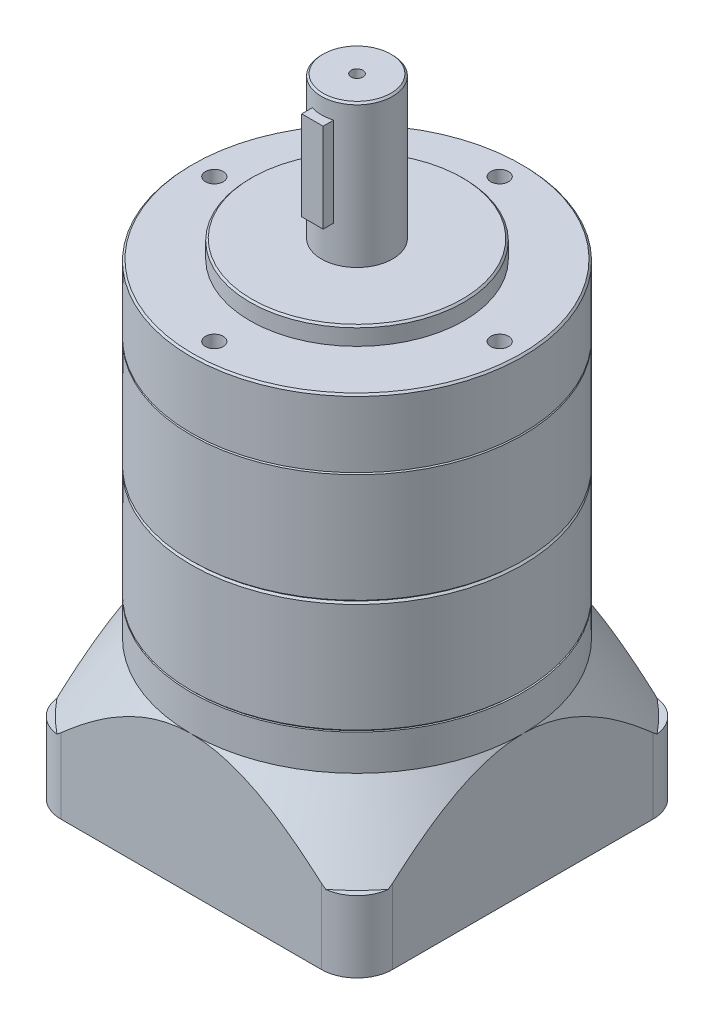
SolidWorks part; units mm, degrees
ref_plane "前基準面" through (0, 0, 0) normal (0, 0, 1) x (1, 0, 0)
ref_plane "上基準面" through (0, 0, 0) normal (0, 1, 0) x (1, 0, 0)
ref_plane "右基準面" through (0, 0, 0) normal (1, 0, 0) x (0, 0, -1)
sketch "草圖1" plane through (0, 0, 0) normal (0, 1, 0) x (1, 0, 0)
  line L1 (-36.5, -46.5) -> (36.5, -46.5)
  line L2 (-46.5, -36.5) -> (-46.5, 36.5)
  line L3 (-36.5, 46.5) -> (36.5, 46.5)
  line L4 (46.5, -36.5) -> (46.5, 36.5)
  line L5 (-46.5, -46.5) -> (46.5, 46.5) construction
  line L6 (-46.5, 46.5) -> (46.5, -46.5) construction
  arc A0 (36.5, -46.5) -> (46.5, -36.5) centre (36.5, -36.5) ccw
  arc A1 (-36.5, -46.5) -> (-46.5, -36.5) centre (-36.5, -36.5) cw
  arc A2 (36.5, 46.5) -> (46.5, 36.5) centre (36.5, 36.5) cw
  arc A3 (-46.5, 36.5) -> (-36.5, 46.5) centre (-36.5, 36.5) cw
  point P0 (0, 0)
  dimension "D3" = 10
  dimension "D1" = 93
  dimension "D2" = 93
extrude "填料-伸長1" add sketch "草圖1" along normal blind 49
sketch "草圖2" plane through (0, 49, 0) normal (0, 1, 0) x (1, 0, 0)
  circle A0 centre (0, 0) radius 46.5
extrude "除料-伸長3" cut sketch "草圖2" along normal blind 10 and the other way blind 19 draft 35 from offset 10 flip side to cut
sketch "草圖3" plane through (0, 49, 0) normal (0, 1, 0) x (1, 0, 0)
  circle A0 centre (0, 0) radius 46.5
extrude "填料-伸長2" add sketch "草圖3" along normal blind 31.5 separate body
sketch "草圖15" plane through (0, 80.5, 0) normal (0, 1, 0) x (1, 0, 0)
  circle A0 centre (0, 0) radius 46.5
extrude "填料-伸長8" add sketch "草圖15" along normal blind 31.5 separate body
sketch "草圖4" plane through (0, 112, 0) normal (0, 1, 0) x (1, 0, 0)
  circle A0 centre (0, 0) radius 46.5
extrude "填料-伸長3" add sketch "草圖4" along normal blind 19 separate body
sketch "草圖6" plane through (0, 131, 0) normal (0, 1, 0) x (1, 0, 0)
  circle A0 centre (0, 0) radius 30
  dimension "D1" = 60
extrude "填料-伸長5" add sketch "草圖6" along normal blind 5
sketch "草圖7" plane through (0, 136, 0) normal (0, 1, 0) x (1, 0, 0)
  circle A0 centre (0, 0) radius 10
  dimension "D1" = 20
extrude "填料-伸長6" add sketch "草圖7" along normal blind 40
chamfer "導角2" distance 0.5 angle 45 3 edges at (0, 176, 10) (0, 131, 46.5) (0, 136, 30)
hole_wizard "M6x1.0 螺紋孔1" positions "草圖9" profile "草圖8" tap size "M6x1.0" standard "JIS"
sketch "草圖9" plane through (0, 131, 0) normal (0, 1, 0) x (1, 0, 0)
  point P0 (0, 40)
sketch "草圖8" plane through (0, 131, -40) normal (1, 0, 0) x (0, 0, 1)
  line L0 (0, 0) -> (0, 16.5022)
  line L1 (0, 16.5022) -> (2.5, 15)
  line L2 (2.5, 15) -> (2.5, 0)
  line L5 (2.5, 0) -> (0, 0)
  line L10 (0, 16.5022) -> (-2.5, 15) construction
  line L11 (0, -6.35) -> (0, 107.95) construction
  dimension "螺孔鑽直徑" = 5
  dimension "螺孔鑽深度" = 15
  dimension "導頭角度" = 118
pattern_circular "環狀複製排列1" count 4 over 360 about axis through (0, 0, 0) along (0, 1, 0) of "M6x1.0 螺紋孔1"
sketch "草圖10" plane through (0, 0, 0) normal (0, 0, 1) x (1, 0, 0)
  line L0 (9.5, 176) -> (-9.5, 176) construction
  line L1 (-3, 171) -> (3, 171)
  line L2 (-3, 171) -> (-3, 146)
  line L3 (-3, 146) -> (3, 146)
  line L4 (3, 171) -> (3, 146)
  line L5 (0, -51.15) -> (0, 51.15) construction
  dimension "D1" = 5
  dimension "D2" = 6
  dimension "D3" = 3
  dimension "D4" = 25
extrude "填料-伸長7" add sketch "草圖10" along normal blind 12.5
sketch "草圖11" plane through (0, 0, 0) normal (0, -1, 0) x (1, 0, 0)
  circle A0 centre (0, 0) radius 35
  dimension "D1" = 70
extrude "除料-伸長4" cut sketch "草圖11" against normal blind 6
sketch "草圖12" plane through (0, 6, 0) normal (0, -1, 0) x (1, 0, 0)
  circle A0 centre (0, 0) radius 10
  dimension "D1" = 20
extrude "除料-伸長5" cut sketch "草圖12" against normal blind 40
hole_wizard "M4x0.7 螺紋孔1" positions "草圖14" profile "草圖13" tap size "M4x0.7" standard "JIS"
sketch "草圖14" plane through (0, 176, 0) normal (0, 1, 0) x (1, 0, 0)
  point P0 (0, 0)
sketch "草圖13" plane through (0, 176, 0) normal (1, 0, 0) x (0, 0, 1)
  line L0 (0, 0) -> (0, 11.0914)
  line L1 (0, 11.0914) -> (1.65, 10.1)
  line L2 (1.65, 10.1) -> (1.65, 0)
  line L5 (1.65, 0) -> (0, 0)
  line L10 (0, 11.0914) -> (-1.65, 10.1) construction
  line L11 (0, -6.35) -> (0, 107.95) construction
  dimension "螺孔鑽直徑" = 3.3
  dimension "螺孔鑽深度" = 10.1
  dimension "導頭角度" = 118
chamfer "導角3" distance 0.5 angle 45 2 edges at (0, 80.5, 46.5) (0, 112, 46.5)
chamfer "導角4" distance 0.5 angle 45 2 edges at (0, 49, 46.5) (0, 80.5, 46.5)
